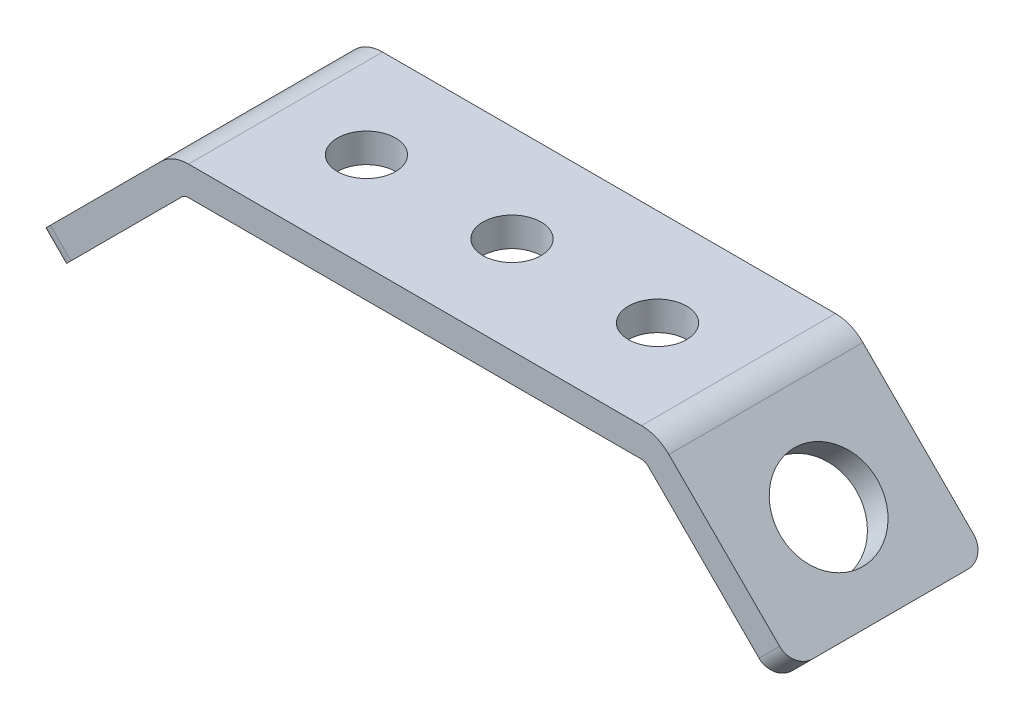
SolidWorks part; units mm, degrees
ref_plane "Front" through (0, 0, 0) normal (0, 0, 1) x (1, 0, 0)
ref_plane "Top" through (0, 0, 0) normal (0, 1, 0) x (1, 0, 0)
ref_plane "Right" through (0, 0, 0) normal (1, 0, 0) x (0, 0, -1)
sketch "Sketch1" plane through (0, 0, 0) normal (0, 0, 1) x (1, 0, 0)
  line L0 (-25, 0) -> (25, 0)
  line L1 (25, 0) -> (39, -14)
  line L2 (0, 0) -> (0, 73.7927) construction
  line L3 (-25, 0) -> (-39, -14)
  point P7 (0, 0)
  dimension "D1" = 50
  dimension "D2" = 14
  dimension "D3" = 135
extrude "Base-Extrude-Thin" add sketch "Sketch1" along normal mid plane 20 thin
sketch "Sketch2" plane through (0, 0, 0) normal (0, 1, 0) x (-1, 0, 0)
  line L0 (0, 0) -> (0, -22.3921) construction
  circle A0 centre (0, 0) radius 3
  circle A1 centre (-15, 0) radius 3
  circle A2 centre (15, 0) radius 3
  dimension "D1" = 6
  dimension "D2" = 15
extrude "Cut-Extrude1" cut sketch "Sketch2" against normal through all
fillet "Fillet1" radius 2 4 edges at (-37.9393, -15.0607, -10) (37.9393, -15.0607, 10) (-37.9393, -15.0607, 10) (37.9393, -15.0607, -10)
sketch "Sketch3" plane through (12.5, 12.5, 0) normal (0.7071, 0.7071, 0) x (0, 0, -1)
  line L0 (0, 50) -> (0, -50) construction
  line L1 (-8, -37.4767) -> (8, -37.4767) construction
  circle A0 centre (0, -28.4767) radius 5
  dimension "D2" = 10
  dimension "D1" = 9
extrude "Cut-Extrude2" cut sketch "Sketch3" against normal up to next
mirror "Mirror1" about plane through (0, 0, 0) normal (1, 0, 0) of "Cut-Extrude2"
